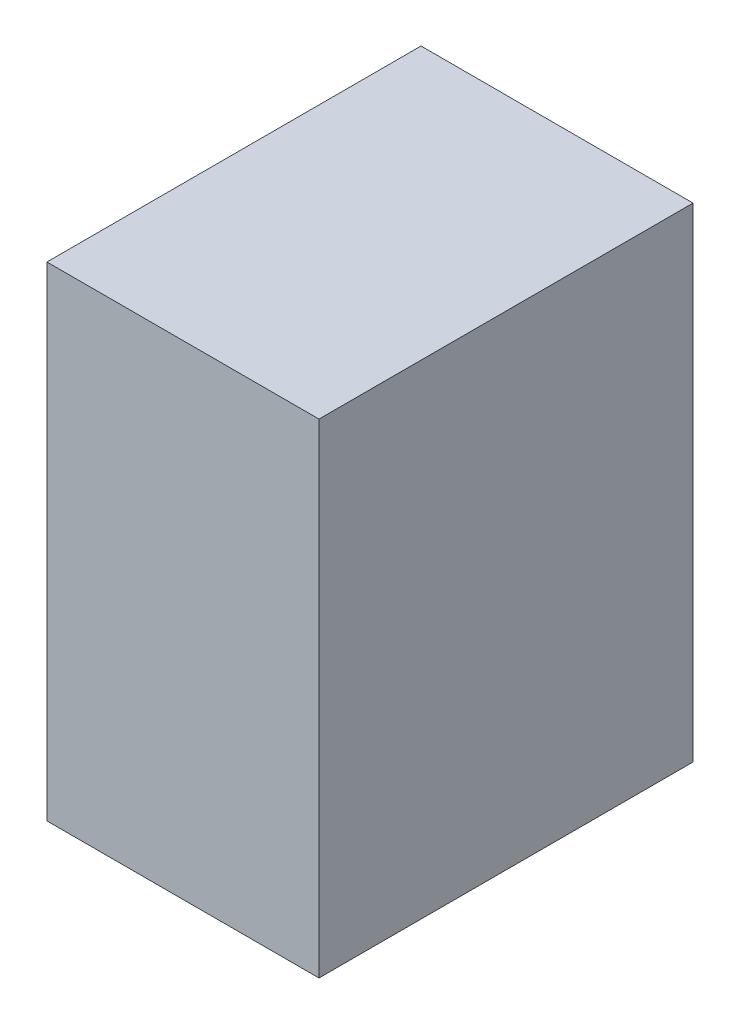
SolidWorks part; units mm, degrees
ref_plane "Спереди" through (0, 0, 0) normal (0, 0, 1) x (1, 0, 0)
ref_plane "Сверху" through (0, 0, 0) normal (0, 1, 0) x (1, 0, 0)
ref_plane "Справа" through (0, 0, 0) normal (1, 0, 0) x (0, 0, -1)
sketch "Эскиз1" plane through (0, 0, 0) normal (0, 0, 1) x (1, 0, 0)
  line L1 (-120, 213.5) -> (120, 213.5)
  line L2 (-120, 213.5) -> (-120, -213.5)
  line L3 (-120, -213.5) -> (120, -213.5)
  line L4 (120, 213.5) -> (120, -213.5)
  line L5 (-120, 213.5) -> (120, -213.5) construction
  line L6 (-120, -213.5) -> (120, 213.5) construction
  point P1 (0, 0)
extrude "Бобышка-Вытянуть1" add sketch "Эскиз1" along normal blind 330
